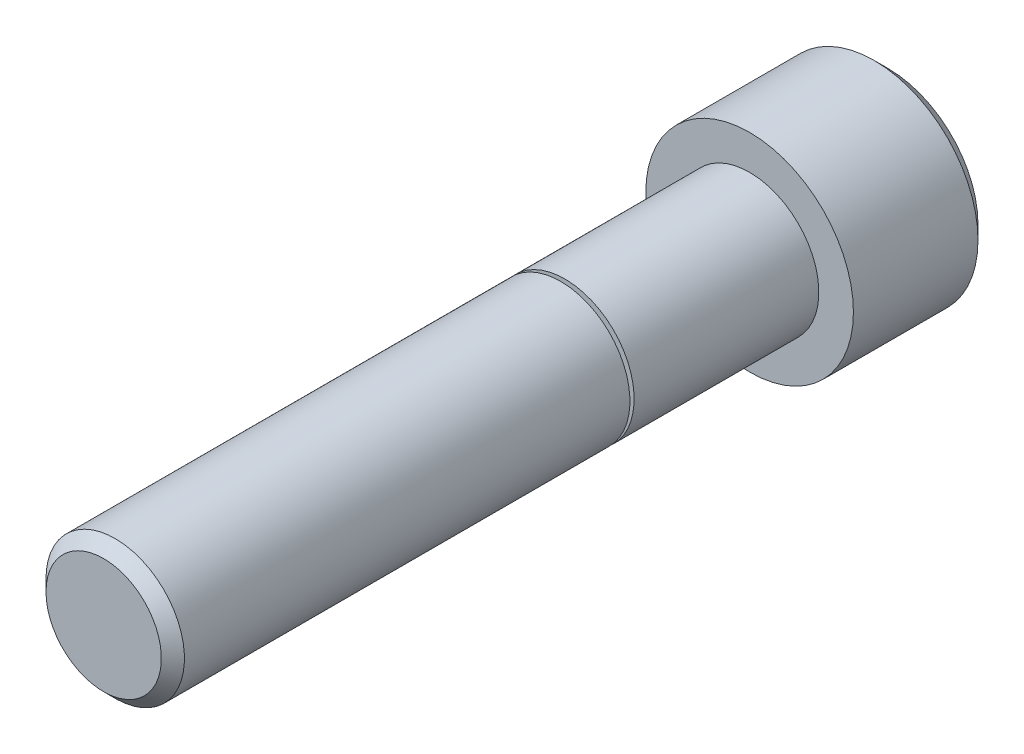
SolidWorks part; units mm, degrees
ref_plane "Front" through (0, 0, 0) normal (0, 0, 1) x (1, 0, 0)
ref_plane "Top" through (0, 0, 0) normal (0, 1, 0) x (1, 0, 0)
ref_plane "Right" through (0, 0, 0) normal (1, 0, 0) x (0, 0, -1)
sketch "Logo3_Revol_Axis" plane through (0, 0, 0) normal (0, 1, 0) x (1, 0, 0)
  line L0 (0, -43.5172) -> (0, 43.5172) construction
sketch "Logo3_bib1" plane through (0, 0, 0) normal (0, -1, 0) x (-1, 0, 0)
  line L0 (0, -44.45) -> (0, 9.525)
  line L1 (0, 9.525) -> (6.1913, 9.525)
  line L2 (7.1438, 8.5725) -> (7.1438, 0)
  line L3 (7.1438, 0) -> (4.7625, 0)
  line L4 (4.7625, 0) -> (4.7625, -12.71)
  line L5 (4.7625, -43.6562) -> (3.9688, -44.45)
  line L6 (3.9688, -44.45) -> (0, -44.45)
  line L7 (4.7625, -12.71) -> (4.0822, -12.71)
  line L8 (4.0753, -12.7488) -> (4.7625, -12.9989)
  line L9 (4.7625, -12.9989) -> (4.7625, -43.6562)
  line L10 (0, 10.5852) -> (0, -63.2873) construction
  line L11 (6.1913, 9.525) -> (7.1438, 8.5725)
  arc A1 (4.0822, -12.71) -> (4.0753, -12.7488) centre (4.0822, -12.73) ccw
  point P17 (3.9688, -12.71)
  point P19 (7.1438, 9.525)
revolve "Revolve1" add sketch "Logo3_bib1" angle 360 about L10
sketch "Logo3_bib2" plane through (0, 0, -9.525) normal (0, 0, -1) x (1, 0, 0)
  line L1 (4.5754, 0) -> (2.2877, 3.9624)
  line L2 (2.2877, 3.9624) -> (-2.2877, 3.9624)
  line L3 (-2.2877, 3.9624) -> (-4.5754, 0)
  line L4 (-4.5754, 0) -> (-2.2877, -3.9624)
  line L5 (-2.2877, -3.9624) -> (2.2877, -3.9624)
  line L6 (2.2877, -3.9624) -> (4.5754, 0)
  circle A0 centre (0, 0) radius 3.9624 construction
  dimension "Logo3_c1" = 7.9248
extrude "Cut-Extrude1" cut sketch "Logo3_bib2" against normal blind 4.7625
equation "\"DIA2@Logo3_bib1\" = \"Logo3_d1-pas@Logo3_bib1\""
equation "\"LGT1@Logo3_bib1\" = \"Logo3_d1@Logo3_bib1\""
equation "\"D1@Cut-Extrude1\" = \"Logo3_d1@Logo3_bib1\"/2."
equation "\"D2@Cosmetic Thread1\" = \"Logo3_d1-pas@Logo3_bib1\""
equation "\"D5@Logo3_bib1\"=\"Logo3_d1@Logo3_bib1\"*.1"
